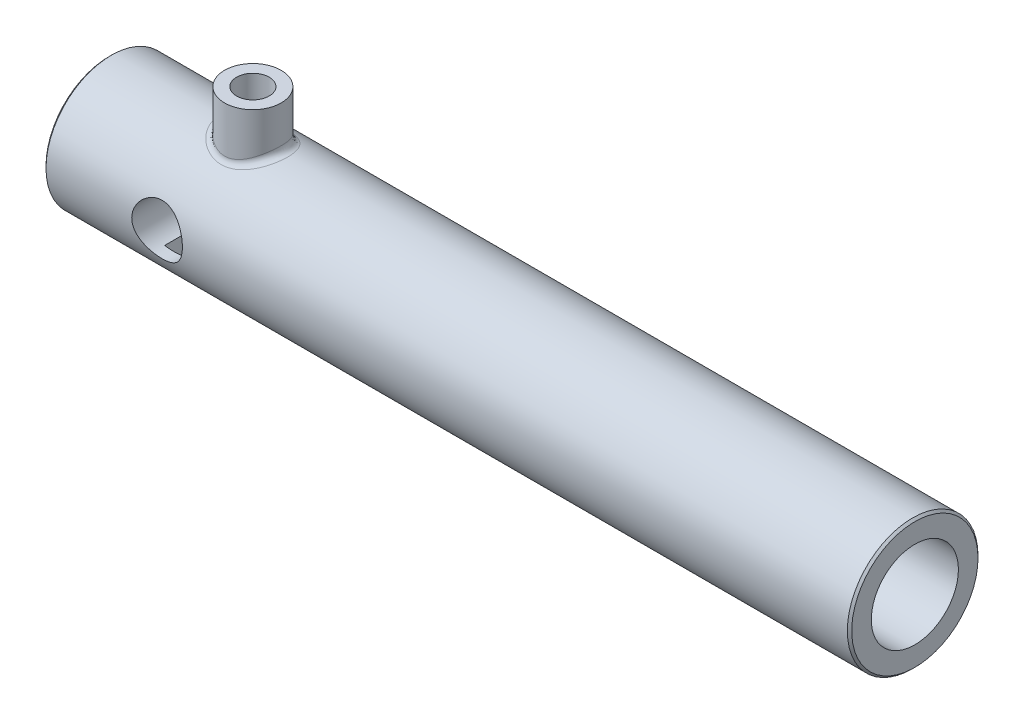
SolidWorks part; units mm, degrees
ref_plane "Plan de face" through (0, 0, 0) normal (0, 0, 1) x (1, 0, 0)
ref_plane "Plan de dessus" through (0, 0, 0) normal (0, 1, 0) x (1, 0, 0)
ref_plane "Plan de droite" through (0, 0, 0) normal (1, 0, 0) x (0, 0, -1)
ref_plane "Plan1" through (0, 0, 0) normal (0, 0, -1) x (-1, 0, 0)
sketch "Esquisse1" plane through (0, 0, 0) normal (0, 0, -1) x (-1, 0, 0)
  line L0 (-320, 30) -> (-320, 0)
  line L1 (-320, 0) -> (50, 0)
  line L2 (50, 0) -> (50, 30)
  line L3 (50, 30) -> (-320, 30)
  line L4 (-320, 0) -> (50, 0) construction
  dimension "D1" = 370
  dimension "D2" = 30
revolve "Révolution1" add sketch "Esquisse1" angle 360 about L4
ref_plane "Plan2" through (66, 0, 0) normal (1, 0, 0) x (0, 0, -1)
ref_plane "Plan3" through (16, 0, 0) normal (1, 0, 0) x (0, 0, -1)
ref_plane "Plan4" through (2, 0, 0) normal (1, 0, 0) x (0, 0, -1)
sketch "Esquisse2" plane through (16, 0, 0) normal (1, 0, 0) x (0, 0, -1)
  line L0 (13, 50) -> (0, 50)
  line L1 (0, 50) -> (0, 27.037)
  line L2 (0, 27.037) -> (13, 27.037)
  line L3 (13, 27.037) -> (13, 50)
  line L4 (0, 50) -> (0, 27.037) construction
revolve "Révolution2" add sketch "Esquisse2" angle 360 about L4
hole_wizard "Diamètre du perçage Ø6.8 (6.8)1" positions "Esquisse5" profile "Esquisse4" hole size "Ø6.8" standard "Ansi Metric"
sketch "Esquisse5" plane through (-50, 0, 0) normal (-1, 0, 0) x (0, 0, 1)
  point P0 (0, 0)
sketch "Esquisse4" plane through (-50, 0, 0) normal (0, 1, 0) x (0, 0, 1)
  line L0 (0, 0) -> (0, 370)
  line L1 (0, 370) -> (3.4, 370)
  line L2 (3.4, 370) -> (3.4, 0)
  line L5 (3.4, 0) -> (0, 0)
  line L11 (0, -6.35) -> (0, 107.95) construction
  dimension "Diamètre du perçage jusqu'au prochain" = 6.8
  dimension "Profondeur du perçage jusqu'au prochain" = 370
hole_wizard "Chambrage pour vis à tête hexagonale M481" positions "Esquisse7" profile "Esquisse6" counterbore size "M48" standard "Ansi Metric"
sketch "Esquisse7" plane through (320, 0, 0) normal (1, 0, 0) x (0, 0, -1)
  point P0 (0, 0)
sketch "Esquisse6" plane through (320, 0, 0) normal (0, 1, 0) x (0, 0, -1)
  line L0 (0, 0) -> (0, 322)
  line L1 (0, 322) -> (25, 322)
  line L2 (25, 322) -> (25, 59)
  line L3 (25, 59) -> (20, 59)
  line L4 (20, 59) -> (20, 0)
  line L5 (20, 0) -> (0, 0)
  line L10 (0, 322) -> (-25, 322) construction
  line L11 (0, -6.35) -> (0, 107.95) construction
  dimension "Diamètre du perçage" = 50
  dimension "Profondeur du perçage" = 322
  dimension "Diamètre du chambrage" = 40
  dimension "Profondeur du chambrage" = 59
  dimension "Angle de pointe" = 180
chamfer "Chanfrein1" distance 1 angle 45 2 edges at (320, 0, 30) (-50, 0, 30)
fillet "Congé1" radius 3 1 edges at (17.7452, 27.0933, 12.8823)
sketch "Esquisse10" plane through (2, 0, 0) normal (1, 0, 0) x (0, 0, -1)
  line L0 (-36.3757, 0) -> (44.2971, 0) construction
  line L2 (-30, 0) -> (-30, 11.625)
  line L3 (-30, 11.625) -> (30, 11.625)
  line L4 (30, 0) -> (30, 11.625)
  line L5 (-30, 0) -> (30, 0)
  dimension "D1" = 30
  dimension "D2" = 30
  dimension "D4" = 11.625
revolve "Enlèvement de matière-Révolution3" cut sketch "Esquisse10" angle 360 about L0
sketch "Esquisse11" plane through (0, 50, 0) normal (0, 1, 0) x (1, 0, 0)
  line L0 (16, -33) -> (16, 33) construction
  circle A0 centre (16, 0) radius 7.5
  dimension "D1" = 15
extrude "Enlèv. mat.-Extru.1" cut sketch "Esquisse11" against normal up to next
